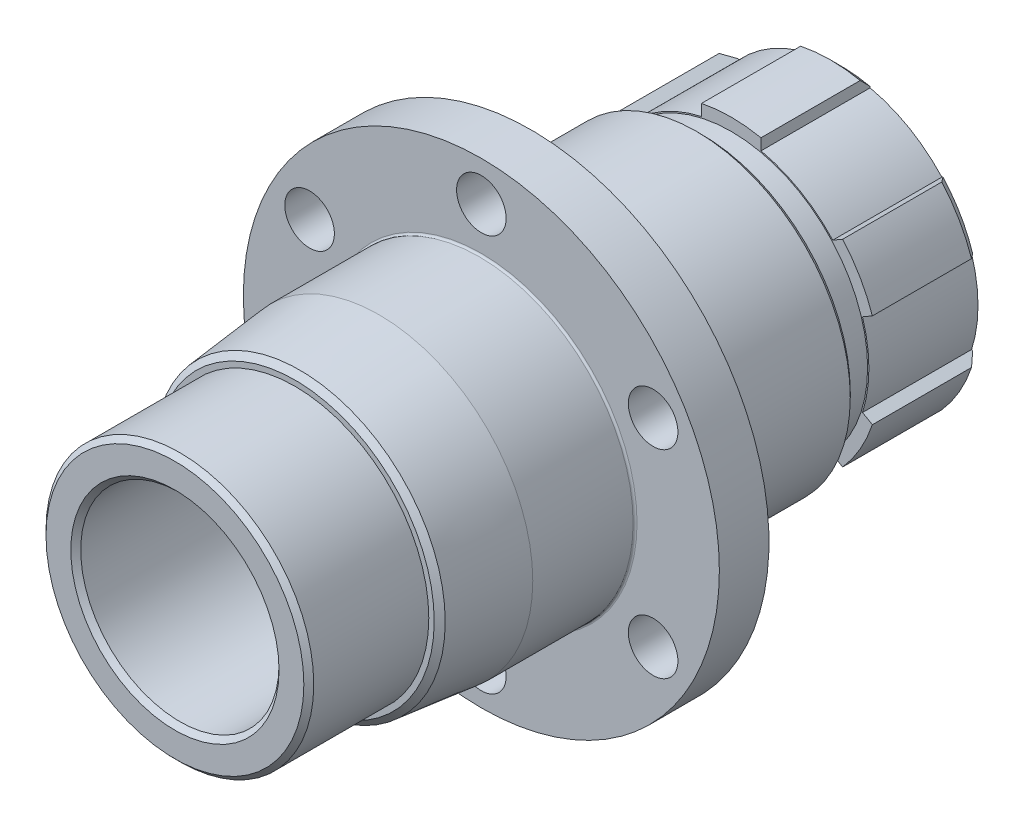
SolidWorks part; units mm, degrees
ref_plane "正面" through (0, 0, 0) normal (0, 0, 1) x (1, 0, 0)
ref_plane "平面" through (0, 0, 0) normal (0, 1, 0) x (1, 0, 0)
ref_plane "右側面" through (0, 0, 0) normal (1, 0, 0) x (0, 0, -1)
sketch "ｽｹｯﾁ1" plane through (0, 0, 0) normal (0, 0, 1) x (1, 0, 0)
  circle A0 centre (0, 0) radius 15
  dimension "D1" = 30
extrude "ﾎﾞｽ - 押し出し1" add sketch "ｽｹｯﾁ1" along normal blind 14
sketch "ｽｹｯﾁ2" plane through (0, 0, 14) normal (0, 0, 1) x (1, 0, 0)
  circle A0 centre (0, 0) radius 13.75
  dimension "D1" = 27.5
extrude "ｶｯﾄ - 押し出し1" cut sketch "ｽｹｯﾁ2" against normal blind 3 flip side to cut
sketch "ｽｹｯﾁ3" plane through (0, 0, 14) normal (0, 0, 1) x (1, 0, 0)
  circle A0 centre (0, 0) radius 15.5
  dimension "D1" = 31
extrude "ﾎﾞｽ - 押し出し2" add sketch "ｽｹｯﾁ3" along normal blind 11.5
sketch "ｽｹｯﾁ4" plane through (0, 0, 25.5) normal (0, 0, 1) x (1, 0, 0)
  circle A0 centre (0, 0) radius 16.5
  dimension "D1" = 33
extrude "ﾎﾞｽ - 押し出し4" add sketch "ｽｹｯﾁ4" along normal offset from surface (29.5 mm away) 41
chamfer "面取り1" distance 18 angle 6 1 edges at (16.5, 0, 55)
sketch "ｽｹｯﾁ5" plane through (0, 0, 55) normal (0, 0, 1) x (1, 0, 0)
  circle A0 centre (0, 0) radius 13.5
  dimension "D1" = 27
extrude "ﾎﾞｽ - 押し出し5" add sketch "ｽｹｯﾁ5" along normal offset from surface (12.1 mm away) 67.1
sketch "ｽｹｯﾁ6" plane through (0, 0, 67.1) normal (0, 0, 1) x (1, 0, 0)
  circle A0 centre (0, 0) radius 10
  dimension "D1" = 20
extrude "ｶｯﾄ - 押し出し2" cut sketch "ｽｹｯﾁ6" against normal through all
sketch "ｽｹｯﾁ7" plane through (0, 0, 67.1) normal (0, 0, 1) x (1, 0, 0)
  circle A0 centre (0, 0) radius 10.5
  dimension "D1" = 21
extrude "ｶｯﾄ - 押し出し3" cut sketch "ｽｹｯﾁ7" against normal blind 34.5 from offset 16.5
chamfer "面取り2" distance 1 angle 45 1 edges at (15, 0, 0)
chamfer "面取り3" distance 0.5 angle 45 1 edges at (15.5, 0, 14)
chamfer "面取り4" distance 0.5 angle 45 1 edges at (10, 0, 0)
chamfer "面取り5" distance 0.5 angle 45 2 edges at (13.5, 0, 67.1) (10, 0, 67.1)
chamfer "面取り6" distance 0.5 angle 45 1 edges at (14.6081, 0, 55)
sketch "ｽｹｯﾁ8" plane through (0, 0, 0) normal (0, 0, -1) x (-1, 0, 0)
  line L0 (3, 19.3761) -> (3, 13.5519)
  line L1 (10.2363, 9.374) -> (14.4514, 11.8076)
  line L2 (0, 0) -> (16.736, 9.6625) construction
  line L3 (0, 0) -> (0, 23.6616) construction
  line L4 (3, 19.3761) -> (14.4514, 11.8076)
  arc A1 (3, 13.5519) -> (10.2363, 9.374) centre (0, 0) cw
  dimension "D1" = 13.88
  dimension "D2" = 3
  dimension "D3" = 3
  dimension "D4" = 60
extrude "ｶｯﾄ - 押し出し4" cut sketch "ｽｹｯﾁ8" against normal up to surface (11 mm away)
pattern_circular "円形ﾊﾟﾀｰﾝ1" count 6 over 360 about axis through (0, 0, 0) along (0, 0, 1) of "ｶｯﾄ - 押し出し4"
sketch "ｽｹｯﾁ9" plane through (0, 0, 25.5) normal (0, 0, -1) x (-1, 0, 0)
  circle A0 centre (0, 0) radius 33.5
  circle A1 centre (0, 0) radius 16.5
  circle A2 centre (0, 0) radius 16.5 construction
  dimension "D1" = 67
extrude "ﾎﾞｽ - 押し出し6" add sketch "ｽｹｯﾁ9" against normal blind 5.7
chamfer "面取り7" distance 1.5 angle 70 2 edges at (-33.5, 0, 31.2) (-33.5, 0, 25.5)
sketch "ｽｹｯﾁ10" plane through (0, 0, 25.5) normal (0, 0, -1) x (-1, 0, 0)
  line L0 (0, 30.54) -> (0, 0) construction
  line L1 (3.6031, 29.0475) -> (5.2743, 33.0822)
  line L2 (-3.6031, 29.0475) -> (-5.2743, 33.0822)
  arc A0 (-3.6031, 29.0475) -> (3.6031, 29.0475) centre (0, 30.54) ccw
  arc A1 (5.2743, 33.0822) -> (-5.2743, 33.0822) centre (0, 0) ccw
  circle A2 centre (0, 0) radius 33.5 construction
  dimension "D1" = 3.9
  dimension "D3" = 45
  dimension "D2" = 30.54
extrude "ｶｯﾄ - 押し出し5" cut sketch "ｽｹｯﾁ10" against normal through all
pattern_circular "円形ﾊﾟﾀｰﾝ2" count 15 over 360 about axis through (0, 0, 0) along (0, 0, 1) of "ｶｯﾄ - 押し出し5"
fillet "ﾌｨﾚｯﾄ1" radius 1 1 edges at (15.5, 0, 25.5)
sketch "ｽｹｯﾁ11" plane through (0, 0, 31.2) normal (0, 0, -1) x (-1, 0, 0)
  circle A0 centre (0, 0) radius 16.5
  circle A1 centre (0, 0) radius 22.5
  circle A3 centre (0, 0) radius 16.5 construction
  dimension "D1" = 45
extrude "ｶｯﾄ - 押し出し6" cut sketch "ｽｹｯﾁ11" along normal blind 1.2
fillet "ﾌｨﾚｯﾄ2" radius 1 2 edges at (-22.5, 0, 30) (-16.5, 0, 30)
sketch "ｽｹｯﾁ12" plane through (0, 0, 31.2) normal (0, 0, 1) x (1, 0, 0)
  circle A0 centre (0, 0) radius 16.5
  circle A1 centre (0, 0) radius 16.5 construction
  circle A2 centre (0, 0) radius 24
  arc A3 (21.0556, 26.0559) -> (18.2741, 28.0768) centre (0, 0) ccw construction
  point P7 (0, -0.5177)
  dimension "D1" = 9.5
extrude "ﾎﾞｽ - 押し出し7" add sketch "ｽｹｯﾁ12" along normal blind 5
sketch "ｽｹｯﾁ13" plane through (0, 0, 25.5) normal (0, 0, -1) x (-1, 0, 0)
  circle A0 centre (0, 0) radius 15.5
  circle A1 centre (0, 0) radius 15.5 construction
extrude "ｶｯﾄ - 押し出し7" cut sketch "ｽｹｯﾁ13" against normal up to surface (5.7 mm away) and the other way blind 4 flip side to cut
fillet "ﾌｨﾚｯﾄ3" [suppressed] radius 1
fillet "ﾌｨﾚｯﾄ4" radius 0.2 1 edges at (-15.5, 0, 31.2)
sketch "ｽｹｯﾁ16" plane through (0, 0, 55) normal (0, 0, 1) x (1, 0, 0)
  circle A0 centre (0, 0) radius 15.5
  dimension "D1" = 31
extrude "ｶｯﾄ - 押し出し8" cut sketch "ｽｹｯﾁ16" against normal up to surface (18.8 mm away) flip side to cut
fillet "ﾌｨﾚｯﾄ5" radius 0.2 1 edges at (15.5, 0, 36.2)
hole_wizard "Ø5.0 (5) 直径の穴1" positions "ｽｹｯﾁ14" profile "ｽｹｯﾁ15" hole size "Ø5.0" standard "JIS"
sketch "ｽｹｯﾁ14" plane through (0, 0, 36.2) normal (0, 0, 1) x (1, 0, 0)
  line L0 (0, 0) -> (0, 20) construction
  point P0 (0, 20)
  point P8 (0, 20.1239)
  dimension "D1" = 20
sketch "ｽｹｯﾁ15" plane through (0, 20, 36.2) normal (1, 0, 0) x (0, -1, 0)
  line L0 (0, 0) -> (0, 36.2)
  line L1 (0, 36.2) -> (2.5, 36.2)
  line L2 (2.5, 36.2) -> (2.5, 0)
  line L5 (2.5, 0) -> (0, 0)
  line L11 (0, -6.35) -> (0, 107.95) construction
  dimension "通し穴の直径" = 5
  dimension "通し穴の深さ" = 36.2
pattern_circular "円形ﾊﾟﾀｰﾝ3" count 6 over 360 about axis through (0, 0, 0) along (0, 0, 1) of "Ø5.0 (5) 直径の穴1"
